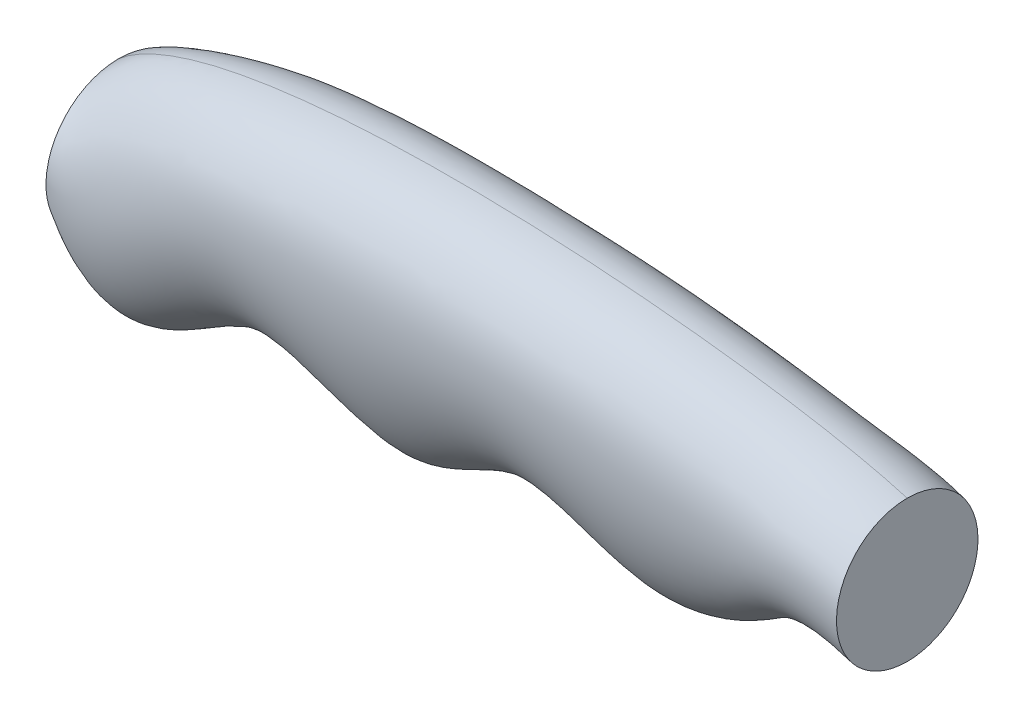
SolidWorks part; units mm, degrees
ref_plane "Vorne (xy)" through (0, 0, 0) normal (0, 0, 1) x (1, 0, 0)
ref_plane "Oben (zx)" through (0, 0, 0) normal (0, 1, 0) x (1, 0, 0)
ref_plane "Rechts (yz)" through (0, 0, 0) normal (1, 0, 0) x (0, 0, -1)
sketch "Skizze1" plane through (0, 0, 0) normal (0, 0, 1) x (1, 0, 0)
  line L0 (0, 0) -> (0, 7.6456) construction
  line L1 (0, 0) -> (0, -13.4579) construction
  spline S0 degree 3 poles (0, 7.6456) (17.3372, 22.4404) (90.6695, 16.7355) (114.7358, 9.634) knots 0 0 0 0 1 1 1 1
  spline S1 degree 3 poles (0, -13.4579) (5.4515, -30.5403) (22.1145, -3.7984) (44.2786, -26.4897) (62.4684, -8.2317) (79.7618, -22.0909) (97.8515, -14.455) (104.4964, -7.6919) (114.7358, -10.9605) knots 0 0 0 0 0.246939 0.415707 0.580167 0.72497 0.875413 1 1 1 1
sketch "Skizze2" plane through (0, 0, 0) normal (1, 0, 0) x (0, 0, -1)
  line L0 (0, 0) -> (0, 7.6456) construction
  line L1 (0, 0) -> (0, -13.4579) construction
  line L2 (0, 7.6737) -> (9.312, 7.6737) construction
  line L3 (0, -13.486) -> (11.0851, -13.486) construction
  arc A0 (0, 7.6737) -> (0, -13.486) centre (0, -2.9061) ccw
ref_plane "Ebene1" through (114.7358, 0, 0) normal (1, 0, 0) x (0, 0, -1)
sketch "Skizze3" plane through (114.7358, 0, 0) normal (1, 0, 0) x (0, 0, -1)
  line L0 (0, 9.634) -> (4.2466, 9.634) construction
  arc A0 (0, 9.634) -> (0, -10.9605) centre (0, -0.6632) ccw
surface "Oberfläche-Ausformung1"
mirror "Spiegeln1" about plane through (0, 0, 0) normal (0, 0, 1)
surface "Oberflächenausfüllung1"
surface "Oberflächenausfüllung2"
surface "Oberfläche-Zusammenfügen1"
